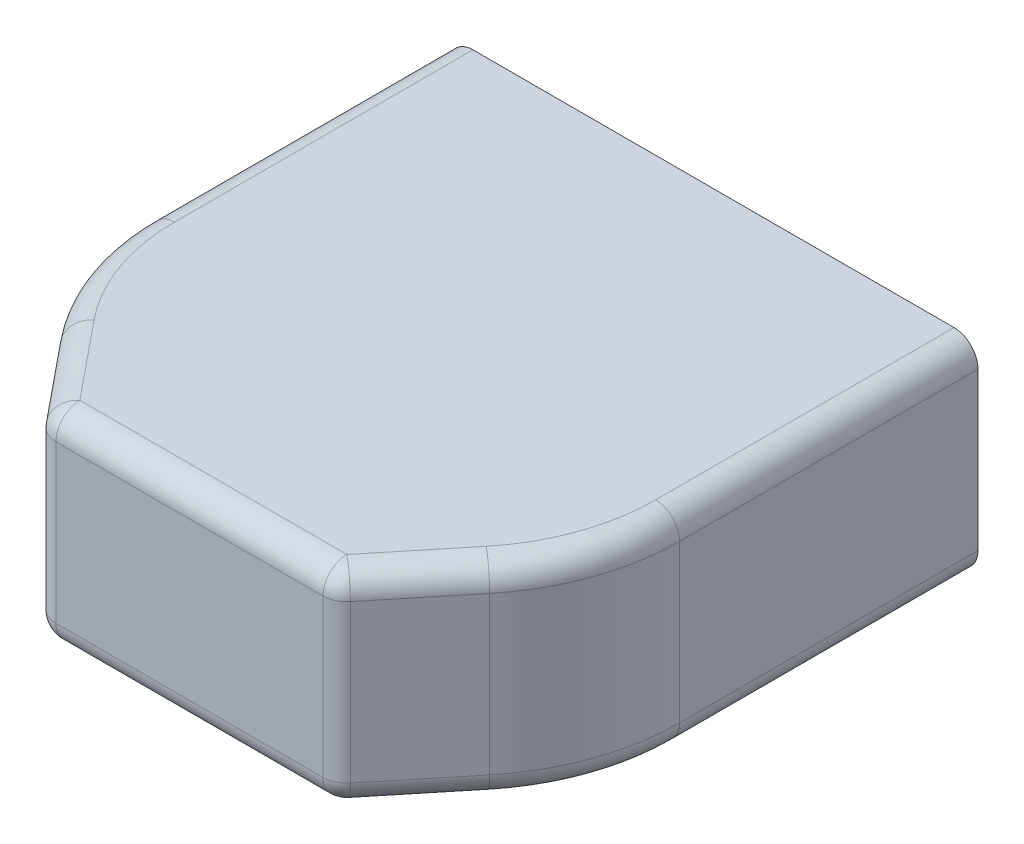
SolidWorks part; units mm, degrees
ref_plane "Front Plane" through (0, 0, 0) normal (0, 0, 1) x (1, 0, 0)
ref_plane "Top Plane" through (0, 0, 0) normal (0, 1, 0) x (1, 0, 0)
ref_plane "Right Plane" through (0, 0, 0) normal (1, 0, 0) x (0, 0, -1)
sketch "Sketch1" plane through (0, 0, 0) normal (0, 1, 0) x (1, 0, 0)
  line L0 (0, 84.8628) -> (0, 0) construction
  line L1 (61.4196, 0) -> (-61.4196, 0)
  line L2 (-61.4196, 0) -> (-112.1422, 62.2072)
  line L3 (-112.1422, 62.2072) -> (-112.1422, 222.1685)
  line L4 (-112.1422, 222.1685) -> (112.1422, 222.1685)
  line L5 (112.1422, 62.2072) -> (112.1422, 222.1685)
  line L6 (61.4196, 0) -> (112.1422, 62.2072)
  point P8 (0, 222.1685)
extrude "Extrude1" add sketch "Sketch1" along normal blind 86.9417
fillet "Fillet1" radius 93.98 2 edges at (112.1422, 43.4708, -62.2072) (-112.1422, 43.4708, -62.2072)
fillet "Fillet2" radius 10.16 2 edges at (-61.4196, 43.4708, 0) (61.4196, 43.4708, 0)
fillet "Fillet3" radius 10.16 18 edges at (-112.1422, 0, -158.9171) (-106.6986, 0, -64.1452) (-77.7337, 0, -20.0079) (-60.9531, 0, -0.9824) (0, 0, 0) (60.9531, 0, -0.9824) (77.7337, 0, -20.0079) (106.6986, 0, -64.1452) (112.1422, 86.9417, -158.9171) (106.6986, 86.9417, -64.1452) (77.7337, 86.9417, -20.0079) (60.9531, 86.9417, -0.9824) (0, 86.9417, 0) (-60.9531, 86.9417, -0.9824) (-77.7337, 86.9417, -20.0079) (-106.6986, 86.9417, -64.1452) (112.1422, 0, -158.9171) (-112.1422, 86.9417, -158.9171)
shell "Shell1" thickness 5.6634
